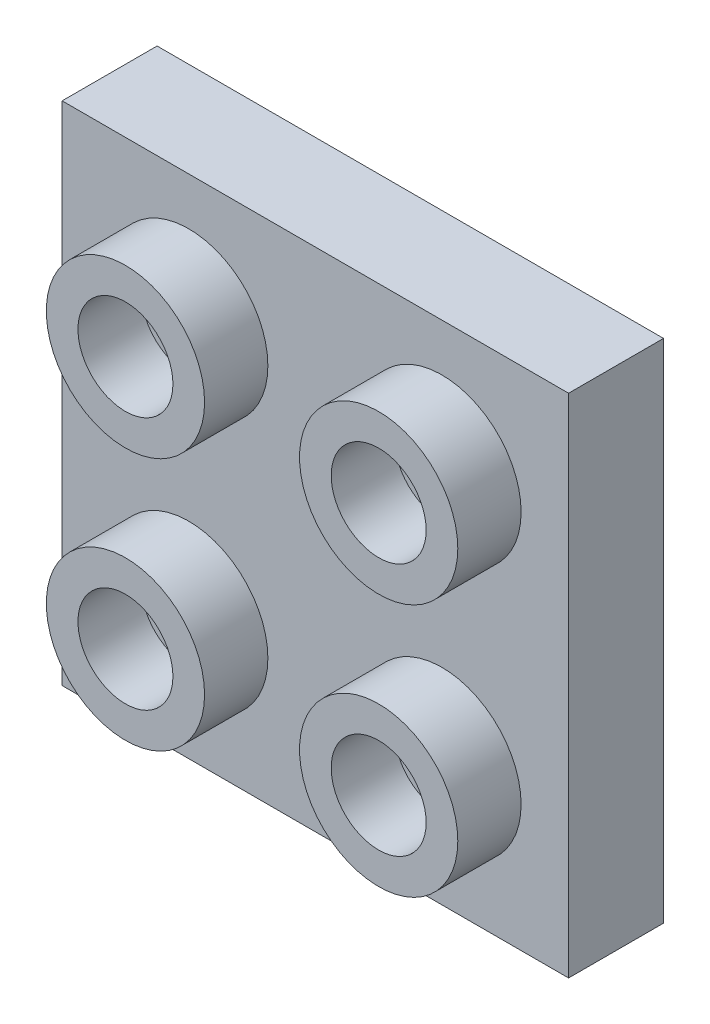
SolidWorks part; units mm, degrees
ref_plane "정면" through (0, 0, 0) normal (0, 0, 1) x (1, 0, 0)
ref_plane "윗면" through (0, 0, 0) normal (0, 1, 0) x (1, 0, 0)
ref_plane "우측면" through (0, 0, 0) normal (1, 0, 0) x (0, 0, -1)
sketch "스케치1" plane through (0.0073, -0.1313, 0) normal (0, 0, 1) x (1, 0, 0)
  line L1 (-8.5849, 7.9996) -> (7.4151, 7.9996)
  line L2 (-8.5849, 7.9996) -> (-8.5849, -8.0004)
  line L3 (-8.5849, -8.0004) -> (7.4151, -8.0004)
  line L4 (7.4151, 7.9996) -> (7.4151, -8.0004)
  dimension "D1" = 16
  dimension "D2" = 16
extrude "베이스돌출" add sketch "스케치1" against normal blind 3
sketch "스케치2" plane through (0, 0, 0) normal (0, 0, 1) x (1, 0, 0)
  line L0 (-8.5776, 7.8683) -> (-8.5776, -8.1317) construction
  line L1 (-8.5776, -8.1317) -> (7.4224, -8.1317) construction
  circle A0 centre (-4.5776, -4.1317) radius 2.5
  dimension "D1" = 5
  dimension "D2" = 4
  dimension "D3" = 4
extrude "보스-돌출1" add sketch "스케치2" along normal blind 2
pattern_linear "선형 패턴1" count 2 spacing 8 along (1, 0, 0) count 2 spacing 8 along (0, 1, 0) of "보스-돌출1"
sketch "스케치3" plane through (0, 0, -3) normal (0, 0, -1) x (-1, 0, 0)
  line L0 (8.5776, -8.1317) -> (-7.4224, -8.1317) construction
  line L1 (7.0776, -6.6317) -> (-5.9224, -6.6317)
  line L2 (7.0776, -6.6317) -> (7.0776, 6.3683)
  line L3 (7.0776, 6.3683) -> (-5.9224, 6.3683)
  line L4 (-5.9224, -6.6317) -> (-5.9224, 6.3683)
  line L5 (-7.4224, -8.1317) -> (-7.4224, 7.8683) construction
  line L6 (-7.4224, 7.8683) -> (8.5776, 7.8683) construction
  line L7 (8.5776, 7.8683) -> (8.5776, -8.1317) construction
  dimension "D1" = 1.5
  dimension "D2" = 1.5
  dimension "D3" = 1.5
  dimension "D4" = 1.5
extrude "컷-돌출1" cut sketch "스케치3" against normal blind 2
sketch "스케치4" plane through (0, -8.1317, 0) normal (0, -1, 0) x (1, 0, 0)
  line L0 (5.9224, 2) -> (0.9224, 2) construction
  line L1 (-8.5776, -3) -> (-8.5776, 0) construction
  line L2 (3.4224, -3.5) -> (3.4224, 0)
  line L3 (3.4224, 0) -> (-4.5776, 0)
  line L4 (-4.5776, -3.5) -> (-4.5776, 0)
  line L5 (-8.5776, 0) -> (7.4224, 0) construction
  arc A0 (-4.5776, -3.5) -> (3.4224, -3.5) centre (-0.5776, -3.5) ccw
  dimension "D1" = 4
  dimension "D2" = 5.5
  dimension "D3" = 8
extrude "Boss-Extrude1" add sketch "스케치4" against normal blind 7
sketch "스케치5" plane through (0, -8.1317, 0) normal (0, -1, 0) x (1, 0, 0)
  circle A0 centre (-0.5776, -3.5) radius 2.45
  arc A1 (-4.5776, -3.5) -> (3.4224, -3.5) centre (-0.5776, -3.5) ccw construction
  dimension "D1" = 4.9
extrude "Cut-Extrude1" cut sketch "스케치5" against normal blind 7
sketch "스케치6" plane through (0, -8.1317, 0) normal (0, -1, 0) x (1, 0, 0)
  circle A0 centre (-0.5776, -3.5) radius 3
  dimension "D1" = 6
extrude "컷-돌출3" cut sketch "스케치6" against normal blind 0.8
sketch "스케치9" plane through (0, 0, 2) normal (0, 0, 1) x (1, 0, 0)
  circle A0 centre (-4.5776, -4.1317) radius 1.5
  circle A1 centre (-4.5776, -4.1317) radius 2.5 construction
  dimension "D1" = 3
extrude "컷-돌출6" cut sketch "스케치9" against normal up to vertex (2 mm away)
pattern_linear "선형 패턴2" count 2 spacing 8 along (0, 1, 0) count 2 spacing 8 along (1, 0, 0) of "컷-돌출6"
